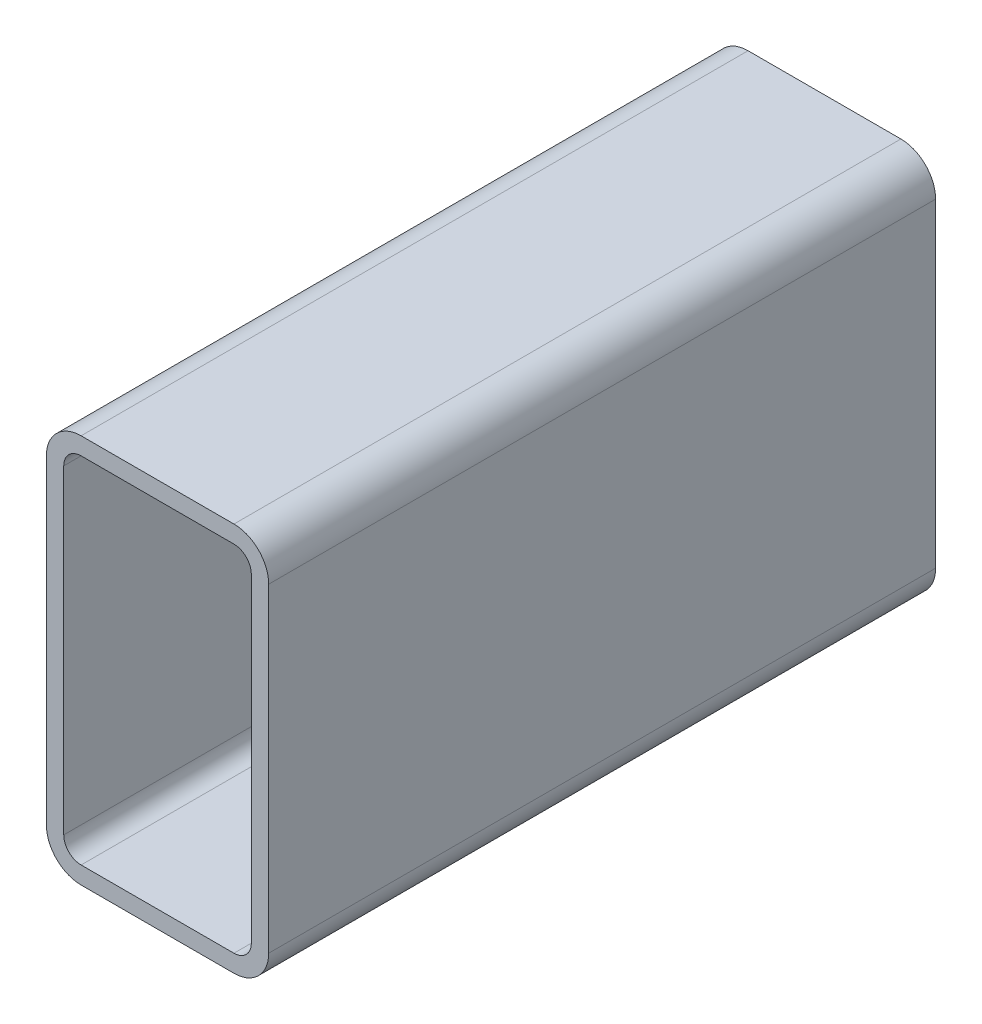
SolidWorks part; units mm, degrees
ref_plane "Front Plane" through (0, 0, 0) normal (0, 0, 1) x (1, 0, 0)
ref_plane "Top Plane" through (0, 0, 0) normal (0, 1, 0) x (1, 0, 0)
ref_plane "Right Plane" through (0, 0, 0) normal (1, 0, 0) x (0, 0, -1)
sketch "Sketch1" plane through (0, 0, 0) normal (0, 0, 1) x (1, 0, 0)
sketch_block_instance "HSS7x4x0.3125-1"
sketch_block "HSS7x4x0.3125"
extrude "Boss-Extrude1" add sketch "Sketch1" along normal blind 304.8
